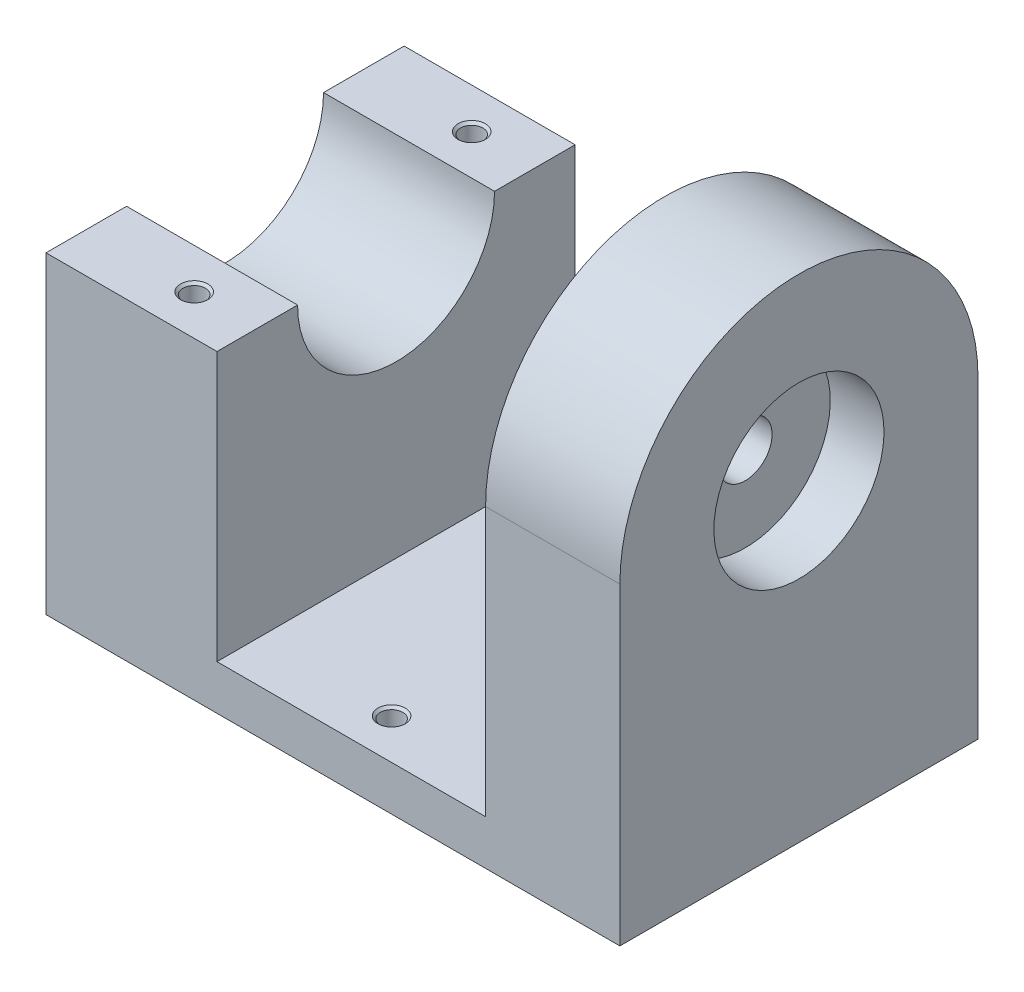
SolidWorks part; units mm, degrees
ref_plane "前视基准面" through (0, 0, 0) normal (0, 0, 1) x (1, 0, 0)
ref_plane "上视基准面" through (0, 0, 0) normal (0, 1, 0) x (1, 0, 0)
ref_plane "右视基准面" through (0, 0, 0) normal (1, 0, 0) x (0, 0, -1)
other "Configuration Table"
sketch "草图1" plane through (0, 0, 0) normal (0, 0, 1) x (1, 0, 0)
  line L0 (-32.05, 0) -> (32.05, 0)
  line L1 (32.05, 0) -> (32.05, 35)
  line L2 (32.05, 35) -> (17.05, 35)
  line L3 (17.05, 35) -> (17.05, 5)
  line L4 (17.05, 5) -> (-12.95, 5)
  line L8 (-32.05, 0) -> (-32.05, 35)
  line L9 (-32.05, 35) -> (-12.95, 35)
  line L10 (-12.95, 35) -> (-12.95, 5)
  point P4 (0, 0)
  dimension "D1" = 19.1
  dimension "D2" = 30
  dimension "D3" = 35
  dimension "D4" = 35
  dimension "D5" = 5
  dimension "D6" = 15
extrude "凸台-拉伸1" add sketch "草图1" along normal blind 40
sketch "草图3" plane through (-32.05, 0, 0) normal (-1, 0, 0) x (0, 0, 1)
  line L0 (40, 35) -> (0, 35) construction
  circle A0 centre (20, 35) radius 11
  dimension "D1" = 22
extrude "切除-拉伸1" cut sketch "草图3" against normal blind 30
sketch "草图4" plane through (32.05, 0, 0) normal (1, 0, 0) x (0, 0, -1)
  line L0 (-40, 35) -> (0, 35) construction
  circle A0 centre (-20, 35) radius 20
extrude "凸台-拉伸2" add sketch "草图4" against normal blind 15
sketch "草图5" plane through (17.05, 0, 0) normal (-1, 0, 0) x (0, 0, 1)
  circle A0 centre (20, 35) radius 9.5
  dimension "D1" = 19
extrude "切除-拉伸2" cut sketch "草图5" against normal blind 6
sketch "草图6" plane through (32.05, 0, 0) normal (1, 0, 0) x (0, 0, -1)
  circle A0 centre (-20, 35) radius 9.5
  dimension "D1" = 19
extrude "切除-拉伸3" cut sketch "草图6" against normal blind 6
sketch "草图7" plane through (23.05, 0, 0) normal (-1, 0, 0) x (0, 0, 1)
  circle A0 centre (20, 35) radius 3
  dimension "D1" = 6
extrude "切除-拉伸4" cut sketch "草图7" against normal blind 19
sketch "草图8" plane through (0, 35, 0) normal (0, 1, 0) x (1, 0, 0)
  line L0 (-12.95, -9) -> (-12.95, 0) construction
  point P0 (-20, -4.5)
  point P1 (-20, -35.5)
sketch "草图9" plane through (0, 5, 0) normal (0, 1, 0) x (1, 0, 0)
  point P0 (2.05, -4.5)
  point P1 (2.05, -35.5)
hole_wizard "M3 螺纹孔1" positions "草图9" profile "草图10" tap size "M3" standard "GB"
sketch "草图10" plane through (2.05, 5, 4.5) normal (1, 0, 0) x (0, 0, 1)
  line L0 (0, 0) -> (0, 12.3511)
  line L1 (0, 12.3511) -> (1.25, 11.6)
  line L2 (1.25, 11.6) -> (1.25, 0.275)
  line L3 (1.25, 0.275) -> (1.525, 0)
  line L5 (1.525, 0) -> (0, 0)
  line L6 (-1.25, 0.275) -> (-1.525, 0) construction
  line L10 (0, 12.3511) -> (-1.25, 11.6) construction
  line L11 (0, -6.35) -> (0, 107.95) construction
  dimension "螺纹孔钻头直径" = 2.5
  dimension "螺纹孔钻头深度" = 11.6
  dimension "近端锥形沉头孔直径" = 3.05
  dimension "近端锥形沉头孔角度" = 90
  dimension "导头角度" = 118
hole_wizard "M3 螺纹孔2" positions "草图8" profile "草图11" tap size "M3" standard "GB"
sketch "草图11" plane through (-20, 35, 4.5) normal (1, 0, 0) x (0, 0, 1)
  line L0 (0, 0) -> (0, 6.7511)
  line L1 (0, 6.7511) -> (1.25, 6)
  line L2 (1.25, 6) -> (1.25, 0.275)
  line L3 (1.25, 0.275) -> (1.525, 0)
  line L5 (1.525, 0) -> (0, 0)
  line L6 (-1.25, 0.275) -> (-1.525, 0) construction
  line L10 (0, 6.7511) -> (-1.25, 6) construction
  line L11 (0, -6.35) -> (0, 107.95) construction
  dimension "螺纹孔钻头直径" = 2.5
  dimension "螺纹孔钻头深度" = 6
  dimension "近端锥形沉头孔直径" = 3.05
  dimension "近端锥形沉头孔角度" = 90
  dimension "导头角度" = 118
